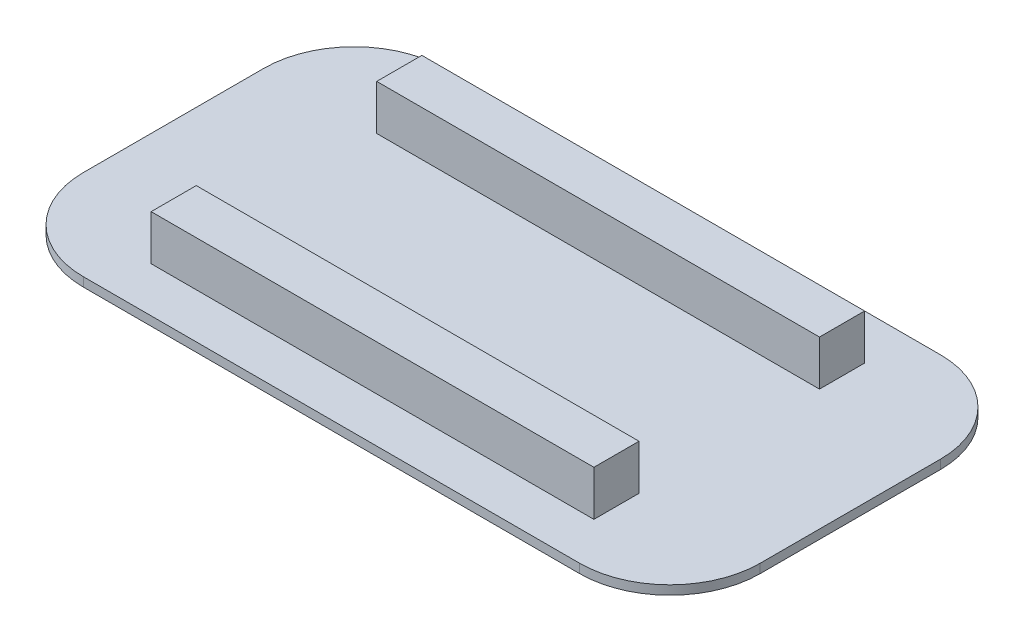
SolidWorks part; units mm, degrees
ref_plane "Ebene vorne" through (0, 0, 0) normal (0, 0, 1) x (1, 0, 0)
ref_plane "Ebene oben" through (0, 0, 0) normal (0, 1, 0) x (1, 0, 0)
ref_plane "Ebene rechts" through (0, 0, 0) normal (1, 0, 0) x (0, 0, -1)
sketch "Skizze1" plane through (0, 0, 0) normal (0, 1, 0) x (1, 0, 0)
  line L1 (-37.5, -20) -> (37.5, -20)
  line L2 (-37.5, -20) -> (-37.5, 20)
  line L3 (-37.5, 20) -> (37.5, 20)
  line L4 (37.5, -20) -> (37.5, 20)
  point P7 (-33.1776, -2.6869)
  dimension "D1" = 75
  dimension "D2" = 40
  dimension "D3" = 20
  dimension "D4" = 37.5
extrude "Aufsatz-Linear austragen1" add sketch "Skizze1" along normal blind 1
fillet "Verrundung1" radius 10 4 edges at (-37.5, 0.5, -20) (37.5, 0.5, -20) (37.5, 0.5, 20) (-37.5, 0.5, 20)
sketch "Skizze2" plane through (0, 1, 0) normal (0, 1, 0) x (1, 0, 0)
  line L0 (27.5, 20) -> (-27.5, 20) construction
  line L1 (24.0764, -15) -> (-24.9912, -15)
  line L2 (24.0764, -15) -> (24.0764, -10)
  line L3 (24.0764, -10) -> (-24.9912, -10)
  line L4 (-24.9912, -15) -> (-24.9912, -10)
  line L5 (24.0764, 10) -> (-24.9912, 10)
  line L6 (24.0764, 10) -> (24.0764, 15)
  line L7 (24.0764, 15) -> (-24.9912, 15)
  line L8 (-24.9912, 10) -> (-24.9912, 15)
  line L9 (-27.5, -20) -> (27.5, -20) construction
  dimension "D1" = 5
  dimension "D2" = 5
  dimension "D3" = 5
  dimension "D4" = 5
extrude "Aufsatz-Linear austragen2" add sketch "Skizze2" along normal blind 5
